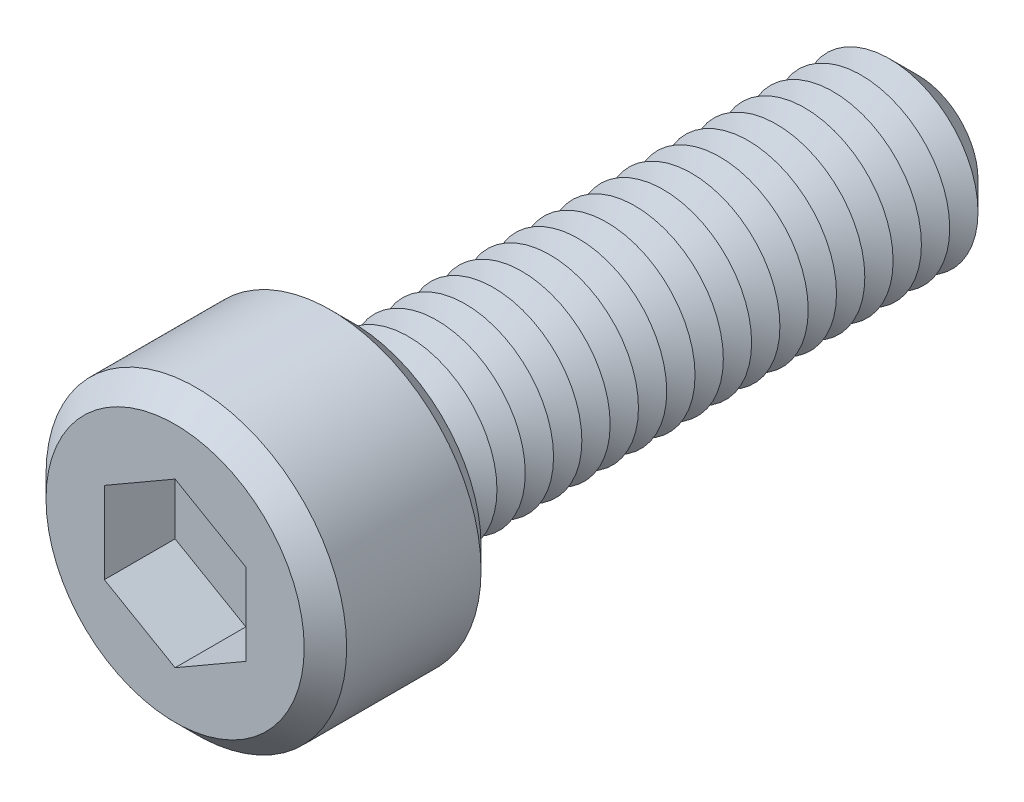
SolidWorks part; units mm, degrees
ref_plane "Front Plane" through (0, 0, 0) normal (0, 0, 1) x (1, 0, 0)
ref_plane "Top Plane" through (0, 0, 0) normal (0, 1, 0) x (1, 0, 0)
ref_plane "Right Plane" through (0, 0, 0) normal (1, 0, 0) x (0, 0, -1)
sketch "Sketch1" plane through (0, 0, 0) normal (0, 0, 1) x (1, 0, 0)
  circle A0 centre (0, 0) radius 4.25
  dimension "D1" = 8.5
extrude "Boss-Extrude1" add sketch "Sketch1" along normal blind 5
sketch "Sketch2" plane through (0, 0, 0) normal (0, 0, -1) x (-1, 0, 0)
  circle A0 centre (0, 0) radius 2.5
  dimension "D1" = 5
extrude "Boss-Extrude2" add sketch "Sketch2" along normal blind 16
chamfer "Chamfer1" distance 0.8 angle 45 1 edges at (-2.5, 0, -16)
sketch "Sketch3" plane through (0, 0, 0) normal (1, 0, 0) x (0, 0, -1)
  line L0 (-2.5121, 0) -> (4.5776, 0) construction
sketch "Sketch4" plane through (0, 0, 0) normal (1, 0, 0) x (0, 0, -1)
  line L0 (0, 2.5) -> (0.4, 1.8072)
  line L1 (0.4, 1.8072) -> (0.8, 2.5)
  line L2 (15.2, 2.5) -> (0, 2.5) construction
  line L3 (0.8, 2.5) -> (0, 2.5)
  dimension "D1" = 0.8
revolve "Cut-Revolve1" cut sketch "Sketch4" angle 360 about L0
pattern_linear "LPattern1" count 19 spacing 0.8 along (0, 0, -1) of "Cut-Revolve1"
sketch "Sketch5" plane through (0, 0, 5) normal (0, 0, 1) x (1, 0, 0)
  line L1 (0, 2.3094) -> (-2, 1.1547)
  line L2 (-2, 1.1547) -> (-2, -1.1547)
  line L3 (-2, -1.1547) -> (0, -2.3094)
  line L4 (0, -2.3094) -> (2, -1.1547)
  line L5 (2, -1.1547) -> (2, 1.1547)
  line L6 (2, 1.1547) -> (0, 2.3094)
  circle A0 centre (0, 0) radius 2 construction
  dimension "D1" = 4
extrude "Cut-Extrude1" cut sketch "Sketch5" against normal blind 2
sketch "Sketch6" plane through (0, 0, 3) normal (0, 0, 1) x (1, 0, 0)
  circle A0 centre (0, 0) radius 0.65
  dimension "D1" = 1.3
extrude "Cut-Extrude2" cut sketch "Sketch6" against normal up to surface (19 mm away)
chamfer "Chamfer2" distance 0.6 angle 45 2 edges at (4.25, 0, 0) (4.25, 0, 5)
